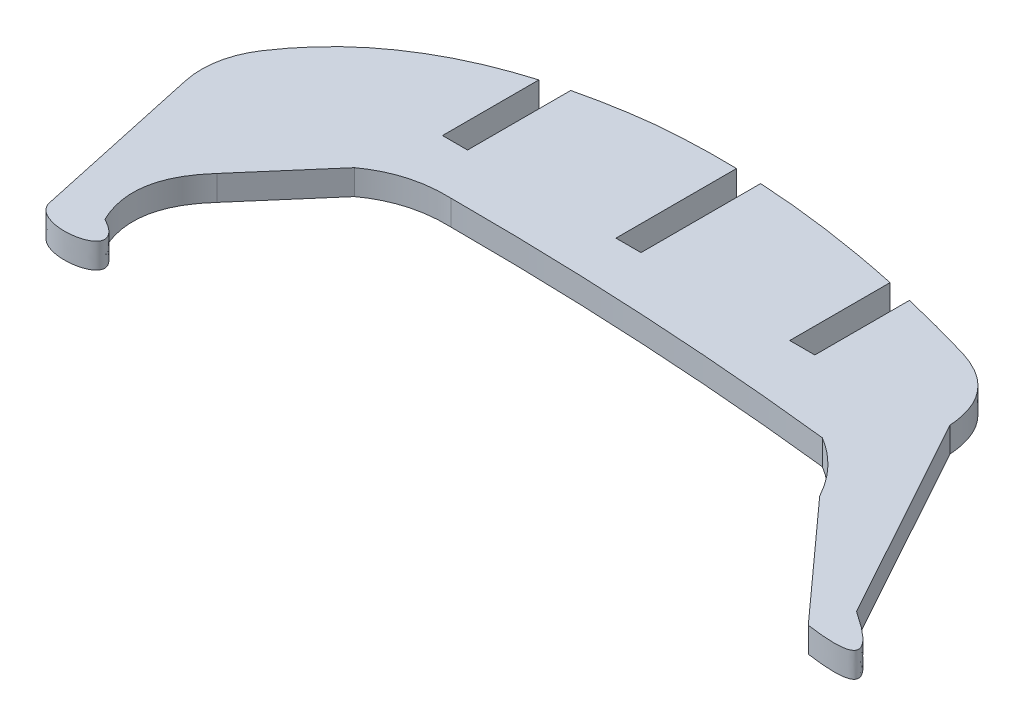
SolidWorks part; units mm, degrees
ref_plane "Alzado" through (0, 0, 0) normal (0, 0, 1) x (1, 0, 0)
ref_plane "Planta" through (0, 0, 0) normal (0, 1, 0) x (1, 0, 0)
ref_plane "Vista lateral" through (0, 0, 0) normal (1, 0, 0) x (0, 0, -1)
sketch "Croquis2" plane through (0, 0, 0) normal (0, 1, 0) x (1, 0, 0)
  line L0 (-20.4658, 21.7939) -> (56.8, 21.7939) construction
  line L1 (55.0566, 13.5654) -> (68.7825, -11.3134)
  line L2 (67.3128, -15.6176) -> (54.6101, -1.5502)
  line L3 (-7.2337, 4.6437) -> (-14.8588, -4.1832)
  line L4 (-21.8908, -16.9764) -> (-26.3406, 3.5498)
  line L7 (36.7066, 24.7648) -> (36.7066, 12.7675)
  line L8 (36.7066, 12.7675) -> (39.7066, 12.7675)
  line L9 (39.7066, 24.0872) -> (39.7066, 12.7675)
  line L10 (15.7066, 27.4047) -> (15.7066, 12.9789)
  line L11 (15.7066, 12.9789) -> (18.7066, 12.9789)
  line L12 (18.7066, 27.2854) -> (18.7066, 12.9789)
  line L14 (-5.2934, 24.7651) -> (-5.2934, 13.232)
  line L15 (-5.2934, 13.232) -> (-2.2934, 13.232)
  line L16 (-2.2934, 25.5718) -> (-2.2934, 13.232)
  line L17 (-35.1, 13.232) -> (76.1186, 13.232) construction
  arc A0 (-26.3406, 3.5498) -> (-24.9178, 11.1706) centre (-16.5676, 5.6684) cw
  spline S0 degree 3 poles (6.2373, 27.0797) (9.2708, 27.3726) (12.4273, 27.4809) (15.7066, 27.4047) knots 0.396666 0.396666 0.396666 0.396666 0.54813 0.54813 0.54813 0.54813
  spline S1 degree 2 poles (48.3379, 21.7939) (54.6503, 19.8549) (55.0566, 13.5654) knots 0 0 0 1 1 1
  spline S2 degree 2 poles (68.7825, -11.3134) (77.5212, -17.0734) (67.3128, -15.6176) knots 0 0 0 1 1 1
  spline S3 degree 2 poles (54.6101, -1.5502) (52.4822, 2.3916) (48.7312, 4.6437) knots 0 0 0 1 1 1
  spline S4 degree 2 poles (48.7312, 4.6437) (25.2502, 7.275) (1.6945, 7.2544) knots 0 0 0 1 1 1
  spline S5 degree 2 poles (-2.2934, 25.5718) (1.9362, 26.5899) (6.2373, 27.0797) knots 0.783563 0.783563 0.783563 1 1 1
  spline S6 degree 2 poles (1.6945, 7.2544) (-3.3871, 7.432) (-7.2337, 4.6437) knots 0 0 0 1 1 1
  spline S7 degree 2 poles (-14.8588, -4.1832) (-19.7412, -9.5993) (-16.8074, -15.6176) knots 0 0 0 1 1 1
  spline S8 degree 3 poles (-16.8074, -15.6176) (-10.2437, -19.1644) (-21.3627, -21.0524) (-21.8908, -16.9764) knots 0 0 0 0 1 1 1 1
  spline S9 degree 3 poles (-24.9178, 11.1706) (-21.216, 16.7884) (-14.6221, 21.5473) (-7.0243, 24.2476) (-5.2934, 24.7651) knots 0.102538 0.102538 0.102538 0.102538 0.571138 0.706216 0.706216 0.706216 0.706216
  spline S10 degree 3 poles (18.7066, 27.2854) (24.3576, 26.9694) (30.3576, 26.1291) (36.7066, 24.7648) knots 0.593802 0.593802 0.593802 0.593802 0.849041 0.849041 0.849041 0.849041
  spline S11 degree 2 poles (39.7066, 24.0872) (43.9231, 23.0895) (48.3379, 21.7939) knots 0.888901 0.888901 0.888901 1 1 1
  dimension "D1" = 10
  dimension "D4" = 18
  dimension "D5" = 18
extrude "Saliente-Extruir1" add sketch "Croquis2" along normal blind 3 contours S10 L7 L8 L9 S11 S1 L1 S2 L2 S3 S4 S6 L3 S7 S8 L4 A0 S9 L14 L15 L16 S5 S0 L10 L11 L12
